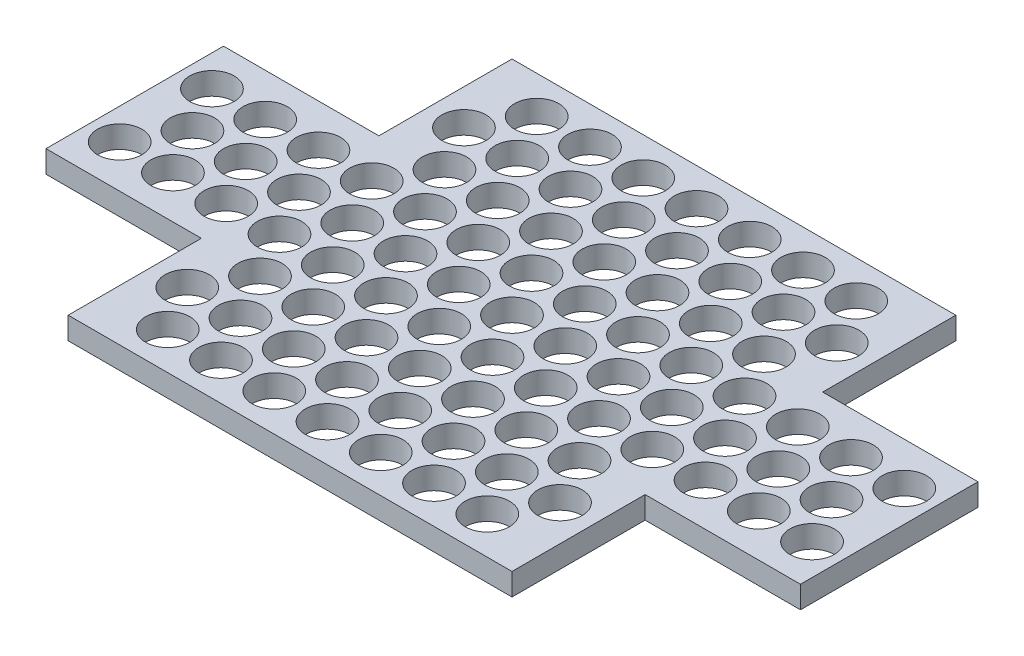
SolidWorks part; units mm, degrees
ref_plane "Front Plane" through (0, 0, 0) normal (0, 0, 1) x (1, 0, 0)
ref_plane "Top Plane" through (0, 0, 0) normal (0, 1, 0) x (1, 0, 0)
ref_plane "Right Plane" through (0, 0, 0) normal (1, 0, 0) x (0, 0, -1)
sketch "Sketch1" plane through (0, 0, 0) normal (0, 1, 0) x (1, 0, 0)
  line L0 (0, 0) -> (0, 100) construction
  line L1 (50, 0) -> (-50, 0)
  line L2 (-50, 0) -> (-50, 30)
  line L3 (-50, 30) -> (-85, 30)
  line L4 (-85, 30) -> (-85, 70)
  line L5 (-85, 70) -> (-50, 70)
  line L6 (-50, 70) -> (-50, 100)
  line L7 (-50, 100) -> (50, 100)
  line L8 (50, 70) -> (50, 100)
  line L9 (85, 70) -> (50, 70)
  line L10 (85, 30) -> (85, 70)
  line L11 (50, 30) -> (85, 30)
  line L12 (50, 0) -> (50, 30)
  dimension "D1" = 40
  dimension "D2" = 100
  dimension "D3" = 50
  dimension "D4" = 35
extrude "Extrude1" add sketch "Sketch1" along normal blind 5
sketch "Sketch3" plane through (0, 5, 0) normal (0, 1, 0) x (-1, 0, 0)
  line L0 (85, -50) -> (-85, -50) construction
  line L3 (85, -70) -> (85, -30) construction
  line L4 (-85, -30) -> (-85, -70) construction
  circle A0 centre (0, -50) radius 5
  dimension "D1" = 10
extrude "Cut-Extrude1" cut sketch "Sketch3" against normal through all
other "Fill Pattern1" parameters "D1"=12, "D2"=60, "D3"=2
other "Fill Pattern2" parameters "D8"=5, "D4"=19.7231, "D5"=19.7231, "D3"=5
